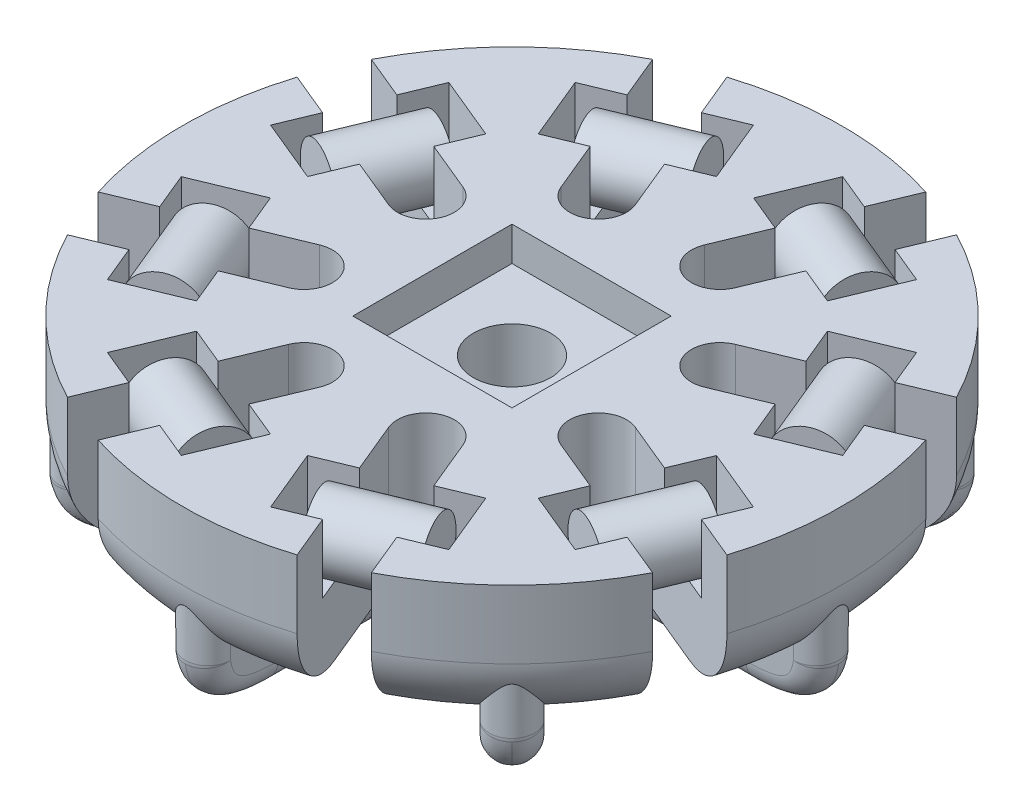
SolidWorks part; units mm, degrees
other "Knotenschale_Unten"
other "Verlinkungsgeometrie"
ref_plane "Ebene vorne" through (0, 0, 0) normal (0, 0, 1) x (1, 0, 0)
ref_plane "Ebene oben" through (0, 0, 0) normal (0, 1, 0) x (1, 0, 0)
ref_plane "Ebene rechts" through (0, 0, 0) normal (1, 0, 0) x (0, 0, -1)
sketch "Mittelachse" plane through (0, 0, 0) normal (0, 0, 1) x (1, 0, 0)
  line L0 (0, 0) -> (0, 6) construction
sketch "Skizze1" plane through (0, 0, 0) normal (0, 1, 0) x (1, 0, 0)
  circle A0 centre (0, 0) radius 14.5
  dimension "D1" = 29
extrude "Aufsatz-Linear austragen1" add sketch "Skizze1" along normal blind 6
fillet "Verrundung1" radius 3 1 edges at (0, 0, 14.5)
sketch "Skizze2" plane through (0, 6, 0) normal (0, 1, 0) x (1, 0, 0)
  line L1 (-3.5, -3.5) -> (3.5, -3.5)
  line L2 (-3.5, -3.5) -> (-3.5, 3.5)
  line L3 (-3.5, 3.5) -> (3.5, 3.5)
  line L4 (3.5, -3.5) -> (3.5, 3.5)
  line L5 (-3.5, -3.5) -> (3.5, 3.5) construction
  line L6 (-3.5, 3.5) -> (3.5, -3.5) construction
  point P0 (0, 0)
  dimension "D1" = 7
  dimension "D2" = 7
extrude "Schnitt-Linear austragen1" cut sketch "Skizze2" against normal blind 1.5
sketch "Skizze4" plane through (0, 6, 0) normal (0, 1, 0) x (1, 0, 0)
  line L0 (0, 0) -> (11.737, 4.8616) construction
  line L1 (6.4672, 2.6788) -> (13.3963, 5.5489) construction
  line L2 (5.9888, 3.8336) -> (12.9179, 6.7038)
  line L3 (6.9455, 1.5239) -> (13.8746, 4.3941)
  line L4 (6.4672, -2.6788) -> (13.3963, -5.5489) construction
  line L5 (6.9455, -1.5239) -> (13.8746, -4.3941)
  line L6 (5.9888, -3.8336) -> (12.9179, -6.7038)
  line L7 (2.6788, -6.4672) -> (5.5489, -13.3963) construction
  line L8 (3.8336, -5.9888) -> (6.7038, -12.9179)
  line L9 (1.5239, -6.9455) -> (4.3941, -13.8746)
  line L10 (-2.6788, -6.4672) -> (-5.5489, -13.3963) construction
  line L11 (-1.5239, -6.9455) -> (-4.3941, -13.8746)
  line L12 (-3.8336, -5.9888) -> (-6.7038, -12.9179)
  line L13 (-6.4672, -2.6788) -> (-13.3963, -5.5489) construction
  line L14 (-5.9888, -3.8336) -> (-12.9179, -6.7038)
  line L15 (-6.9455, -1.5239) -> (-13.8746, -4.3941)
  line L16 (-6.4672, 2.6788) -> (-13.3963, 5.5489) construction
  line L17 (-6.9455, 1.5239) -> (-13.8746, 4.3941)
  line L18 (-5.9888, 3.8336) -> (-12.9179, 6.7038)
  line L19 (-2.6788, 6.4672) -> (-5.5489, 13.3963) construction
  line L20 (-3.8336, 5.9888) -> (-6.7038, 12.9179)
  line L21 (-1.5239, 6.9455) -> (-4.3941, 13.8746)
  line L22 (2.6788, 6.4672) -> (5.5489, 13.3963) construction
  line L23 (1.5239, 6.9455) -> (4.3941, 13.8746)
  line L24 (3.8336, 5.9888) -> (6.7038, 12.9179)
  line L25 (0, 0) -> (6.4672, 2.6788) construction
  circle A0 centre (0, 0) radius 7 construction
  circle A1 centre (0, 0) radius 14.5 construction
  arc A2 (5.9888, 3.8336) -> (6.9455, 1.5239) centre (6.4672, 2.6788) ccw
  arc A3 (13.8746, 4.3941) -> (12.9179, 6.7038) centre (13.3963, 5.5489) ccw
  arc A4 (6.9455, -1.5239) -> (5.9888, -3.8336) centre (6.4672, -2.6788) ccw
  arc A5 (12.9179, -6.7038) -> (13.8746, -4.3941) centre (13.3963, -5.5489) ccw
  arc A6 (3.8336, -5.9888) -> (1.5239, -6.9455) centre (2.6788, -6.4672) ccw
  arc A7 (4.3941, -13.8746) -> (6.7038, -12.9179) centre (5.5489, -13.3963) ccw
  arc A8 (-1.5239, -6.9455) -> (-3.8336, -5.9888) centre (-2.6788, -6.4672) ccw
  arc A9 (-6.7038, -12.9179) -> (-4.3941, -13.8746) centre (-5.5489, -13.3963) ccw
  arc A10 (-5.9888, -3.8336) -> (-6.9455, -1.5239) centre (-6.4672, -2.6788) ccw
  arc A11 (-13.8746, -4.3941) -> (-12.9179, -6.7038) centre (-13.3963, -5.5489) ccw
  arc A12 (-6.9455, 1.5239) -> (-5.9888, 3.8336) centre (-6.4672, 2.6788) ccw
  arc A13 (-12.9179, 6.7038) -> (-13.8746, 4.3941) centre (-13.3963, 5.5489) ccw
  arc A14 (-3.8336, 5.9888) -> (-1.5239, 6.9455) centre (-2.6788, 6.4672) ccw
  arc A15 (-4.3941, 13.8746) -> (-6.7038, 12.9179) centre (-5.5489, 13.3963) ccw
  arc A16 (1.5239, 6.9455) -> (3.8336, 5.9888) centre (2.6788, 6.4672) ccw
  arc A17 (6.7038, 12.9179) -> (4.3941, 13.8746) centre (5.5489, 13.3963) ccw
  point P10 (9.9317, 4.1138)
  point P19 (9.9317, -4.1138)
  point P26 (4.1138, -9.9317)
  point P33 (-4.1138, -9.9317)
  point P40 (-9.9317, -4.1138)
  point P47 (-9.9317, 4.1138)
  point P54 (-4.1138, 9.9317)
  point P61 (4.1138, 9.9317)
  dimension "D1" = 14
  dimension "D2" = 1.25
  dimension "D3" = 8
extrude "Schnitt-Linear austragen3" cut sketch "Skizze4" against normal through all
sketch "Skizze6" plane through (0, 6, 0) normal (0, 1, 0) x (1, 0, 0)
  line L0 (0, 0) -> (7.1916, 2.9789) construction
  line L1 (7.5133, -6.3593) -> (10.285, -7.5073)
  line L2 (9.8094, 0.816) -> (12.5811, 1.9641)
  line L3 (9.8094, 0.816) -> (7.5133, 6.3593)
  line L4 (7.5133, 6.3593) -> (10.285, 7.5073)
  line L5 (12.5811, 1.9641) -> (10.285, 7.5073)
  line L6 (9.8094, 0.816) -> (10.285, 7.5073) construction
  line L7 (7.5133, 6.3593) -> (12.5811, 1.9641) construction
  line L8 (7.5133, -6.3593) -> (9.8094, -0.816)
  line L9 (9.8094, -0.816) -> (12.5811, -1.9641)
  line L10 (10.285, -7.5073) -> (12.5811, -1.9641)
  line L11 (7.5133, -6.3593) -> (12.5811, -1.9641) construction
  line L12 (9.8094, -0.816) -> (10.285, -7.5073) construction
  line L13 (0.816, -9.8094) -> (1.9641, -12.5811)
  line L14 (0.816, -9.8094) -> (6.3593, -7.5133)
  line L15 (6.3593, -7.5133) -> (7.5073, -10.285)
  line L16 (1.9641, -12.5811) -> (7.5073, -10.285)
  line L17 (0.816, -9.8094) -> (7.5073, -10.285) construction
  line L18 (6.3593, -7.5133) -> (1.9641, -12.5811) construction
  line L19 (-6.3593, -7.5133) -> (-7.5073, -10.285)
  line L20 (-6.3593, -7.5133) -> (-0.816, -9.8094)
  line L21 (-0.816, -9.8094) -> (-1.9641, -12.5811)
  line L22 (-7.5073, -10.285) -> (-1.9641, -12.5811)
  line L23 (-6.3593, -7.5133) -> (-1.9641, -12.5811) construction
  line L24 (-0.816, -9.8094) -> (-7.5073, -10.285) construction
  line L25 (-9.8094, -0.816) -> (-12.5811, -1.9641)
  line L26 (-9.8094, -0.816) -> (-7.5133, -6.3593)
  line L27 (-7.5133, -6.3593) -> (-10.285, -7.5073)
  line L28 (-12.5811, -1.9641) -> (-10.285, -7.5073)
  line L29 (-9.8094, -0.816) -> (-10.285, -7.5073) construction
  line L30 (-7.5133, -6.3593) -> (-12.5811, -1.9641) construction
  line L31 (-7.5133, 6.3593) -> (-10.285, 7.5073)
  line L32 (-7.5133, 6.3593) -> (-9.8094, 0.816)
  line L33 (-9.8094, 0.816) -> (-12.5811, 1.9641)
  line L34 (-10.285, 7.5073) -> (-12.5811, 1.9641)
  line L35 (-7.5133, 6.3593) -> (-12.5811, 1.9641) construction
  line L36 (-9.8094, 0.816) -> (-10.285, 7.5073) construction
  line L37 (-0.816, 9.8094) -> (-1.9641, 12.5811)
  line L38 (-0.816, 9.8094) -> (-6.3593, 7.5133)
  line L39 (-6.3593, 7.5133) -> (-7.5073, 10.285)
  line L40 (-1.9641, 12.5811) -> (-7.5073, 10.285)
  line L41 (-0.816, 9.8094) -> (-7.5073, 10.285) construction
  line L42 (-6.3593, 7.5133) -> (-1.9641, 12.5811) construction
  line L43 (6.3593, 7.5133) -> (7.5073, 10.285)
  line L44 (6.3593, 7.5133) -> (0.816, 9.8094)
  line L45 (0.816, 9.8094) -> (1.9641, 12.5811)
  line L46 (7.5073, 10.285) -> (1.9641, 12.5811)
  line L47 (6.3593, 7.5133) -> (1.9641, 12.5811) construction
  line L48 (0.816, 9.8094) -> (7.5073, 10.285) construction
  line L49 (0, 0) -> (5.6904, 13.7379) construction
  circle A0 centre (0, 0) radius 9.375 construction
  point P2 (10.0472, 4.1617)
  point P13 (10.0472, -4.1617)
  point P18 (4.1617, -10.0472)
  point P23 (-4.1617, -10.0472)
  point P28 (-10.0472, -4.1617)
  point P33 (-10.0472, 4.1617)
  point P38 (-4.1617, 10.0472)
  point P43 (4.1617, 10.0472)
  point P48 (0, 0)
  dimension "D1" = 18.75
  dimension "D2" = 3
  dimension "D3" = 6
  dimension "D4" = 8
extrude "Schnitt-Linear austragen6" cut sketch "Skizze6" against normal blind 3
sketch "Skizze13" plane through (0, 4.5, 0) normal (0, 1, 0) x (1, 0, 0)
  circle A0 centre (0, 0) radius 3
  dimension "D1" = 6
sketch "Skizze14" plane through (0, 0, 0) normal (0, -1, 0) x (1, 0, 0)
  line L0 (-5.5, 0) -> (-13.375, 0) construction
  line L1 (-5.5, -1) -> (-13.375, -1)
  line L2 (-5.5, 1) -> (-13.375, 1)
  line L3 (-3.8891, 3.8891) -> (-9.4576, 9.4576) construction
  line L4 (-4.5962, 3.182) -> (-10.1647, 8.7504)
  line L5 (-3.182, 4.5962) -> (-8.7504, 10.1647)
  line L6 (0, 5.5) -> (0, 13.375) construction
  line L7 (-1, 5.5) -> (-1, 13.375)
  line L8 (1, 5.5) -> (1, 13.375)
  line L9 (3.8891, 3.8891) -> (9.4576, 9.4576) construction
  line L10 (3.182, 4.5962) -> (8.7504, 10.1647)
  line L11 (4.5962, 3.182) -> (10.1647, 8.7504)
  line L12 (5.5, 0) -> (13.375, 0) construction
  line L13 (5.5, 1) -> (13.375, 1)
  line L14 (5.5, -1) -> (13.375, -1)
  line L15 (3.8891, -3.8891) -> (9.4576, -9.4576) construction
  line L16 (4.5962, -3.182) -> (10.1647, -8.7504)
  line L17 (3.182, -4.5962) -> (8.7504, -10.1647)
  line L18 (0, -5.5) -> (0, -13.375) construction
  line L19 (1, -5.5) -> (1, -13.375)
  line L20 (-1, -5.5) -> (-1, -13.375)
  line L21 (-3.8891, -3.8891) -> (-9.4576, -9.4576) construction
  line L22 (-3.182, -4.5962) -> (-8.7504, -10.1647)
  line L23 (-4.5962, -3.182) -> (-10.1647, -8.7504)
  arc A0 (-5.5, -1) -> (-5.5, 1) centre (-5.5, 0) ccw
  arc A1 (-13.375, 1) -> (-13.375, -1) centre (-13.375, 0) ccw
  circle A2 centre (0, 0) radius 13.375 construction
  circle A3 centre (0, 0) radius 5.5 construction
  arc A4 (-4.5962, 3.182) -> (-3.182, 4.5962) centre (-3.8891, 3.8891) ccw
  arc A5 (-8.7504, 10.1647) -> (-10.1647, 8.7504) centre (-9.4576, 9.4576) ccw
  arc A6 (-1, 5.5) -> (1, 5.5) centre (0, 5.5) ccw
  arc A7 (1, 13.375) -> (-1, 13.375) centre (0, 13.375) ccw
  arc A8 (3.182, 4.5962) -> (4.5962, 3.182) centre (3.8891, 3.8891) ccw
  arc A9 (10.1647, 8.7504) -> (8.7504, 10.1647) centre (9.4576, 9.4576) ccw
  arc A10 (5.5, 1) -> (5.5, -1) centre (5.5, 0) ccw
  arc A11 (13.375, -1) -> (13.375, 1) centre (13.375, 0) ccw
  arc A12 (4.5962, -3.182) -> (3.182, -4.5962) centre (3.8891, -3.8891) ccw
  arc A13 (8.7504, -10.1647) -> (10.1647, -8.7504) centre (9.4576, -9.4576) ccw
  arc A14 (1, -5.5) -> (-1, -5.5) centre (0, -5.5) ccw
  arc A15 (-1, -13.375) -> (1, -13.375) centre (0, -13.375) ccw
  arc A16 (-3.182, -4.5962) -> (-4.5962, -3.182) centre (-3.8891, -3.8891) ccw
  arc A17 (-10.1647, -8.7504) -> (-8.7504, -10.1647) centre (-9.4576, -9.4576) ccw
  point P3 (-9.4375, 0)
  point P16 (-6.6733, 6.6733)
  point P23 (0, 9.4375)
  point P30 (6.6733, 6.6733)
  point P37 (9.4375, 0)
  point P44 (6.6733, -6.6733)
  point P51 (0, -9.4375)
  point P58 (-6.6733, -6.6733)
  point P63 (0, 0)
  dimension "D1" = 11
  dimension "D2" = 26.75
  dimension "D3" = 2
  dimension "D4" = 8
extrude "Aufsatz-Linear austragen8" add sketch "Skizze14" along normal blind 2 and the other way up to next
fillet "Verrundung45" radius 1 32 edges at (-7.3804, -2, 5.9662) (-10.1647, -2, 10.1647) (-5.9662, -2, 7.3804) (-3.182, -2, 3.182) (-1, -2, 9.4375) (0, -2, 14.375) (1, -2, 9.4375) (0, -2, 4.5) (5.9662, -2, 7.3804) (10.1647, -2, 10.1647) (7.3804, -2, 5.9662) (3.182, -2, 3.182) (9.4375, -2, 1) (14.375, -2, 0) (9.4375, -2, -1) (4.5, -2, 0) (7.3804, -2, -5.9662) (10.1647, -2, -10.1647) (5.9662, -2, -7.3804) (3.182, -2, -3.182) (1, -2, -9.4375) (0, -2, -14.375) (-1, -2, -9.4375) (0, -2, -4.5) (-5.9662, -2, -7.3804) (-10.1647, -2, -10.1647) (-7.3804, -2, -5.9662) (-3.182, -2, -3.182) (-9.4375, -2, -1) (-14.375, -2, 0) (-9.4375, -2, 1) (-4.5, -2, 0)
ref_plane "Ebene2" through (0, 0, 0) normal (0, 0, -1) x (-1, 0, 0)
sketch "Skizze18" plane through (0, 0, 0) normal (0, 0, -1) x (-1, 0, 0)
  line L0 (0, -2.0511) -> (0, 1.6509) construction
  line L2 (14.4079, 0.5135) -> (14.9887, -1.0854)
  line L4 (11.2259, -2) -> (7.9366, -2)
  line L5 (14.9887, -1.0854) -> (14.9887, -2.5271)
  line L6 (14.9887, -2.5271) -> (4.1358, -2.7744)
  line L8 (4.1358, -2.7744) -> (4.1358, -0.291)
  line L9 (4.1358, -0.291) -> (4.5, 0)
  spline S0 degree 3 poles (7.9366, -2) (5.8093, -1.9225) (5.1013, -2.355) (4.5, 0) knots 0 0 0 0 1 1 1 1
  spline S1 degree 3 poles (11.2259, -2) (13.1561, -2.0045) (14.3828, -1.589) (14.4079, 0.5135) knots 0 0 0 0 1 1 1 1
revolve "Schnitt-Rotation8" cut sketch "Skizze18" angle 360 about L0
fillet "Verrundung46" radius 1 72 edges at (9.0399, -1.4288, -10.2586) (10.3832, -1.2542, -9.1773) (10.1444, 0.0044, -10.1843) (7.9839, -2, -7.9805) (13.6455, -1.4293, -0.8617) (13.8314, -1.2542, 0.8527) (14.3746, 0.0044, -0.0282) (11.2885, -2, 0.0024) (4.5137, -0.0647, 0.1651) (4.51, -0.0473, -0.1409) (5.1342, -1.5513, -0.7498) (7.9164, -1.9993, -0.0379) (5.006, -1.4031, 0.7704) (3.3084, -0.0647, -3.0749) (3.0894, -0.0473, -3.2887) (2.9424, -1.2904, -4.0284) (5.5709, -1.9993, -5.6246) (4.1006, -1.4351, -3.0139) (-0.8617, -1.4293, -13.6455) (0.8527, -1.2542, -13.8314) (-0.0282, 0.0044, -14.3746) (0.0024, -2, -11.2885) (0.1651, -0.0647, -4.5137) (-0.1409, -0.0473, -4.51) (-0.7498, -1.5513, -5.1342) (-0.0379, -1.9993, -7.9164) (0.7704, -1.4031, -5.006) (-10.2586, -1.4288, -9.0399) (-9.1773, -1.2542, -10.3832) (-10.1843, 0.0044, -10.1444) (-7.9805, -2, -7.9839) (-3.0749, -0.0647, -3.3084) (-3.2887, -0.0473, -3.0894) (-4.0284, -1.2904, -2.9424) (-5.6246, -1.9993, -5.5709) (-3.0139, -1.4351, -4.1006) (3.0749, -0.0647, 3.3084) (3.2887, -0.0473, 3.0894) (4.0284, -1.2904, 2.9424) (5.6246, -1.9993, 5.5709) (3.0139, -1.4351, 4.1006) (10.2586, -1.4288, 9.0399) (9.1773, -1.2542, 10.3832) (10.1843, 0.0044, 10.1444) (7.9805, -2, 7.9839) (-0.1651, -0.0647, 4.5137) (0.1409, -0.0473, 4.51) (0.7498, -1.5513, 5.1342) (0.0379, -1.9993, 7.9164) (-0.7704, -1.4031, 5.006) (-0.8527, -1.2542, 13.8314) (0.8617, -1.4293, 13.6455) (0.0282, 0.0044, 14.3746) (-0.0024, -2, 11.2885) (-3.3084, -0.0647, 3.0749) (-3.0894, -0.0473, 3.2887) (-2.9424, -1.2904, 4.0284) (-5.5709, -1.9993, 5.6246) (-4.1006, -1.4351, 3.0139) (-9.0399, -1.4288, 10.2586) (-10.3832, -1.2542, 9.1773) (-10.1444, 0.0044, 10.1843) (-7.9839, -2, 7.9805) (-4.5132, -0.0623, -0.1619) (-4.5123, -0.058, 0.1562) (-5.1342, -1.5513, 0.7498) (-7.9164, -1.9993, 0.0379) (-5.006, -1.4031, -0.7704) (-13.8314, -1.2542, -0.8527) (-13.6455, -1.4293, 0.8617) (-14.3746, 0.0044, 0.0282) (-11.2885, -2, -0.0024)
hole_wizard "Formsenkung fur M3 Senkschraube mit Schlitz/Kreuzschlitz1" positions "Skizze20" profile "Skizze19" countersink size "M3" standard "Ansi Metrisch"
sketch "Skizze20" plane through (0, 0, 0) normal (0, -1, 0) x (-1, 0, 0)
  point P0 (0, 0)
sketch "Skizze19" plane through (0, 0, 0) normal (1, 0, 0) x (0, 0, -1)
  line L0 (0, 0) -> (0, 6)
  line L1 (0, 6) -> (1.7, 6)
  line L2 (1.7, 6) -> (1.7, 1.45)
  line L3 (1.7, 1.45) -> (3.15, 0)
  line L5 (3.15, 0) -> (0, 0)
  line L6 (-1.7, 1.45) -> (-3.15, 0) construction
  line L11 (0, -6.35) -> (0, 107.95) construction
  dimension "Bohrerdurchmesser" = 3.4
  dimension "Bohrungstiefe" = 6
  dimension "Senkdurchmesser (Oben)" = 6.3
  dimension "Senkwinkel (Oben)" = 90
ref_plane "Ebene3" through (0.7654, 0, -1.8478) normal (-0.3827, 0, 0.9239) x (0.9239, 0, 0.3827)
sketch "Skizze21" plane through (0.7654, 0, -1.8478) normal (-0.3827, 0, 0.9239) x (0.9239, 0, 0.3827)
  line L0 (-10.875, 6) -> (-10.875, 3) construction
  line L1 (-12.375, 3) -> (-12.375, 6) construction
  line L2 (-9.375, 3) -> (-9.375, 6) construction
  line L3 (-12.375, 4.5) -> (-9.375, 4.5) construction
  line L4 (-9.375, 6) -> (-12.375, 6) construction
  line L5 (-9.375, 3) -> (-12.375, 3) construction
  circle A0 centre (-10.875, 4.5) radius 1.5
  point P12 (-10.875, 4.5)
extrude "Aufsatz-Linear austragen9" add sketch "Skizze21" along normal blind 4 separate body
pattern_circular "Kreismuster1" count 8 over 360 about axis through (0, 0, 0) along (0, 1, 0)
